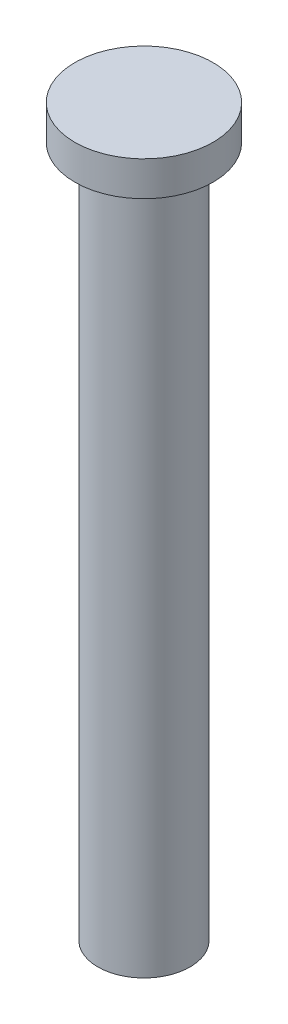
SolidWorks part; units mm, degrees
ref_plane "前视基准面" through (0, 0, 0) normal (0, 0, 1) x (1, 0, 0)
ref_plane "上视基准面" through (0, 0, 0) normal (0, 1, 0) x (1, 0, 0)
ref_plane "右视基准面" through (0, 0, 0) normal (1, 0, 0) x (0, 0, -1)
sketch "草图1" plane through (0, 0, 0) normal (0, 1, 0) x (1, 0, 0)
  circle A0 centre (0, 0) radius 4
  dimension "D1" = 8
extrude "凸台-拉伸1" add sketch "草图1" along normal blind 60
sketch "草图2" plane through (0, 60, 0) normal (0, 1, 0) x (1, 0, 0)
  circle A0 centre (0, 0) radius 6
  dimension "D1" = 12
extrude "凸台-拉伸2" add sketch "草图2" along normal blind 3
